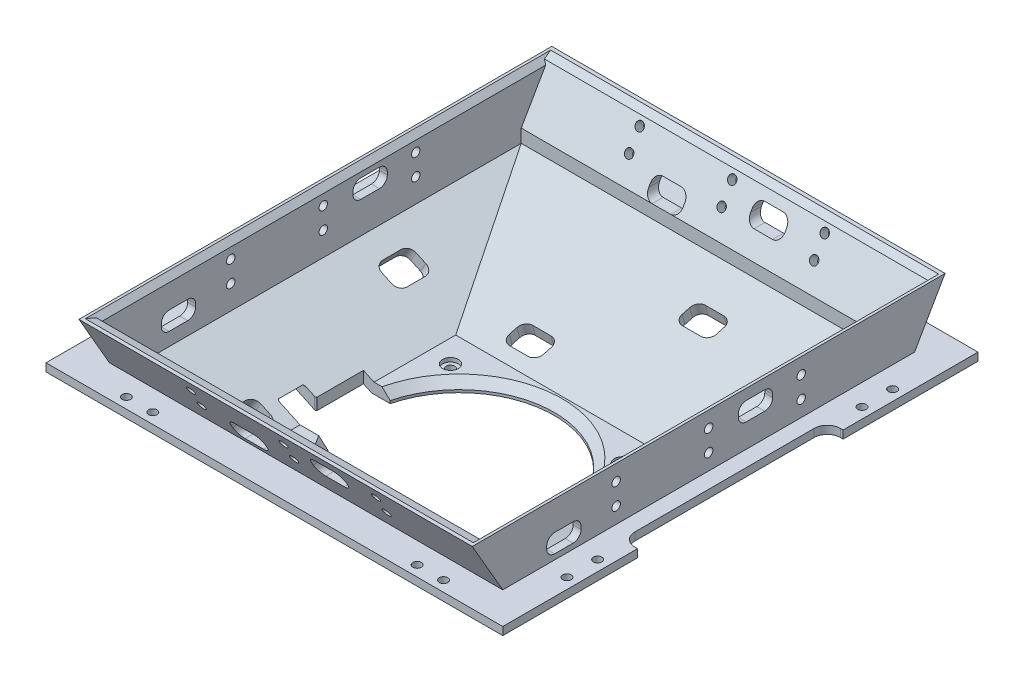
SolidWorks part; units mm, degrees
ref_plane "前视基准面" through (0, 0, 0) normal (0, 0, 1) x (1, 0, 0)
ref_plane "上视基准面" through (0, 0, 0) normal (0, 1, 0) x (1, 0, 0)
ref_plane "右视基准面" through (0, 0, 0) normal (1, 0, 0) x (0, 0, -1)
sketch "草图1" plane through (0, 0, 0) normal (0, 1, 0) x (1, 0, 0)
  line L1 (-42, -41) -> (42, -41)
  line L2 (-42, -41) -> (-42, 41)
  line L3 (-42, 41) -> (42, 41)
  line L4 (42, -41) -> (42, 41)
  line L5 (-42, -41) -> (42, 41) construction
  line L6 (-42, 41) -> (42, -41) construction
  point P0 (0, 0)
  dimension "D1" = 82
  dimension "D2" = 84
ref_plane "基准面1" through (0, 20, 0) normal (0, 1, 0) x (1, 0, 0)
sketch "草图2" plane through (0, 20, 0) normal (0, 1, 0) x (1, 0, 0)
  line L1 (-85, -55) -> (75, -55)
  line L2 (-85, -55) -> (-85, 115)
  line L3 (-85, 115) -> (75, 115)
  line L4 (75, -55) -> (75, 115)
  line L5 (-85, -55) -> (75, 115) construction
  line L6 (-85, 115) -> (75, -55) construction
  point P0 (-5, 30)
  dimension "D1" = 5
  dimension "D2" = 30
  dimension "D3" = 170
  dimension "D4" = 160
loft "放样1" add profiles "草图2", "草图1"
shell "抽壳2" thickness 10
sketch "草图3" plane through (0, 4, 0) normal (0, 1, 0) x (1, 0, 0)
  line L0 (-41.1153, 0.7758) -> (40.8825, 0.7758) construction
  line L1 (-41.1153, 40.469) -> (-41.1153, -38.9174) construction
  line L2 (40.8825, -38.9174) -> (40.8825, 40.469) construction
  circle A0 centre (-0.1164, 0.7758) radius 36
  dimension "D1" = 72
extrude "切除-拉伸1" cut sketch "草图3" against normal blind 10
sketch "草图4" plane through (0, 4, 0) normal (0, 1, 0) x (1, 0, 0)
  line L0 (-0.1164, -35.2242) -> (-0.1164, -17.9785) construction
  line L1 (0, 0) -> (-14.5879, 0) construction
  circle A0 centre (-32.6164, -30) radius 1.6
  circle A1 centre (-0.1164, 0.7758) radius 36 construction
  circle A2 centre (32.3836, -30) radius 1.6
  circle A3 centre (-32.6164, 30) radius 1.6
  circle A4 centre (32.3836, 30) radius 1.6
  dimension "D1" = 3.2
  dimension "D2" = 32.5
  dimension "D3" = 30
extrude "切除-拉伸2" cut sketch "草图4" against normal blind 10
sketch "草图5" plane through (0, 4, 0) normal (0, 1, 0) x (1, 0, 0)
  line L0 (-0.1164, 36.7758) -> (-0.1164, 21.4642) construction
  line L1 (0, 0) -> (8.9854, 0) construction
  circle A0 centre (-32.6164, 30) radius 3
  circle A1 centre (-0.1164, 0.7758) radius 36 construction
  circle A2 centre (32.3836, 30) radius 3
  circle A3 centre (-32.6164, -30) radius 3
  circle A4 centre (32.3836, -30) radius 3
  dimension "D1" = 6
extrude "切除-拉伸3" cut sketch "草图5" against normal blind 1.5
sketch "草图6" plane through (0, 20, 0) normal (0, 1, 0) x (1, 0, 0)
  line L0 (-40.1164, 0.5963) -> (-30.4123, 0.5963) construction
  line L1 (-45.1164, -18.4037) -> (-0.1164, -18.4037)
  line L2 (-45.1164, -18.4037) -> (-45.1164, 9.5963)
  line L3 (-45.1164, 9.5963) -> (-0.1164, 9.5963)
  line L4 (-0.1164, -18.4037) -> (-0.1164, 9.5963)
  dimension "D1" = 9
  dimension "D2" = 28
extrude "切除-拉伸4" cut sketch "草图6" against normal through all
sketch "草图7" plane through (0, 20, 0) normal (0, 1, 0) x (1, 0, 0)
  line L0 (-75.5153, 99.669) -> (-75.5153, -50.1174) construction
  line L1 (-75.5153, -50.1174) -> (67.2825, -50.1174) construction
  line L2 (67.2825, -50.1174) -> (67.2825, 99.669) construction
  line L3 (67.2825, 99.669) -> (-75.5153, 99.669) construction
  line L4 (-75.5153, 99.669) -> (-75.5153, -50.1174)
  line L5 (-75.5153, -50.1174) -> (67.2825, -50.1174)
  line L6 (67.2825, -50.1174) -> (67.2825, 99.669)
  line L7 (67.2825, 99.669) -> (-75.5153, 99.669)
  line L9 (-90.5153, 114.669) -> (82.2825, 114.669)
  line L10 (-90.5153, 114.669) -> (-90.5153, -65.1174)
  line L11 (-90.5153, -65.1174) -> (82.2825, -65.1174)
  line L12 (82.2825, 114.669) -> (82.2825, -65.1174)
  dimension "D1" = 15
  dimension "D2" = 15
  dimension "D3" = 15
  dimension "D4" = 15
extrude "凸台-拉伸1" add sketch "草图7" along normal blind 3
sketch "草图8" plane through (0, 23, 0) normal (0, 1, 0) x (1, 0, 0)
  line L0 (82.2825, -65.1174) -> (82.2825, 114.669) construction
  line L1 (82.2825, -14.1174) -> (76.2825, -14.1174)
  line L2 (82.2825, -14.1174) -> (82.2825, 63.669)
  line L3 (82.2825, 63.669) -> (76.2825, 63.669)
  line L4 (76.2825, -14.1174) -> (76.2825, 63.669)
  line L5 (-90.5153, -65.1174) -> (82.2825, -65.1174) construction
  line L6 (82.2825, 114.669) -> (-90.5153, 114.669) construction
  dimension "D1" = 51
  dimension "D2" = 51
  dimension "D3" = 6
extrude "切除-拉伸5" cut sketch "草图8" against normal blind 4
fillet "圆角1" radius 5 2 edges at (76.2825, 21.5, -63.669) (76.2825, 21.5, 14.1174)
sketch "草图9" plane through (0, 23, 0) normal (0, 1, 0) x (1, 0, 0)
  line L0 (-75.5153, -50.1174) -> (67.2825, -50.1174) construction
  line L1 (-75.5153, 99.669) -> (-75.5153, -50.1174) construction
  line L2 (67.2825, 99.669) -> (-75.5153, 99.669) construction
  line L3 (67.2825, -50.1174) -> (67.2825, 99.669) construction
  line L4 (-75.5153, -50.1174) -> (67.2825, -50.1174)
  line L5 (-75.5153, 99.669) -> (-75.5153, -50.1174)
  line L6 (67.2825, 99.669) -> (-75.5153, 99.669)
  line L7 (67.2825, -50.1174) -> (67.2825, 99.669)
  line L16 (70.2825, 102.669) -> (-78.5153, 102.669)
  line L17 (-78.5153, 102.669) -> (-78.5153, -53.1174)
  line L18 (-78.5153, -53.1174) -> (70.2825, -53.1174)
  line L19 (70.2825, -53.1174) -> (70.2825, 102.669)
  dimension "D1" = 3
extrude "凸台-拉伸2" add sketch "草图9" along normal blind 20
sketch "草图10" plane through (70.2825, 0, 0) normal (1, 0, 0) x (0, 0, -1)
  line L0 (102.669, 43) -> (114.216, 43)
  line L1 (114.216, 43) -> (102.669, 23)
  line L2 (63.669, 23) -> (114.669, 23) construction
  line L3 (102.669, 43) -> (102.669, 23) construction
  line L4 (102.669, 23) -> (102.669, 43)
  line L5 (24.7758, 43) -> (24.7758, 27.2549) construction
  line L6 (-53.1174, 43) -> (102.669, 43) construction
  line L7 (-53.1174, 23) -> (-53.1174, 43)
  line L8 (-64.6644, 43) -> (-53.1174, 23)
  line L9 (-53.1174, 43) -> (-64.6644, 43)
  dimension "D1" = 60
extrude "凸台-拉伸3" add sketch "草图10" against normal up to surface (148.7978 mm away)
chamfer "倒角1" distance 18 angle 30 1 edges at (-4.1164, 43, 50.1174)
chamfer "倒角2" distance 18 angle 30 1 edges at (-4.1164, 43, -99.669)
sketch "草图11" plane through (70.2825, 0, 0) normal (1, 0, 0) x (0, 0, -1)
  line L0 (-61.2003, 37) -> (104.4055, 37) construction
  line L1 (-64.6644, 43) -> (-53.1174, 23) construction
  line L2 (-64.6644, 43) -> (114.216, 43) construction
  line L3 (24.7758, 43) -> (24.7758, 24.953) construction
  circle A0 centre (24.7758, 37) radius 1.6
  circle A1 centre (-10.2242, 37) radius 1.6
  circle A2 centre (59.7758, 37) radius 1.6
  circle A3 centre (59.7758, 29) radius 1.6
  circle A4 centre (24.7758, 29) radius 1.6
  circle A5 centre (-10.2242, 29) radius 1.6
  dimension "D2" = 3.2
  dimension "D3" = 3.2
  dimension "D4" = 35
  dimension "D1" = 6
  dimension "D5" = 2
extrude "切除-拉伸6" cut sketch "草图11" against normal through all
sketch "草图12" plane through (0, -38.707, -67.0424) normal (0, -0.5, -0.866) x (-1, 0, 0)
  line L0 (-70.2825, 88.3471) -> (78.5153, 88.3471) construction
  line L1 (-70.2825, 71.2531) -> (-70.2825, 94.3471) construction
  line L2 (78.5153, 94.3471) -> (78.5153, 71.2531) construction
  line L3 (78.5153, 94.3471) -> (-70.2825, 94.3471) construction
  line L4 (4.1164, 94.3471) -> (4.1164, 80.1243) construction
  circle A0 centre (-30.8836, 88.3471) radius 1.6
  circle A1 centre (4.1164, 88.3471) radius 1.6
  circle A2 centre (39.1164, 88.3471) radius 1.6
  circle A3 centre (-30.8836, 80.3471) radius 1.6
  circle A4 centre (4.1164, 80.3471) radius 1.6
  circle A5 centre (39.1164, 80.3471) radius 1.6
  dimension "D2" = 3.2
  dimension "D3" = 3.2
  dimension "D4" = 35
  dimension "D5" = 2
  dimension "D1" = 6
extrude "切除-拉伸7" cut sketch "草图12" against normal blind 20
sketch "草图14" plane through (0, -17.2505, 29.8787) normal (0, -0.5, 0.866) x (1, 0, 0)
  line L0 (-78.5153, 63.5713) -> (70.2825, 63.5713) construction
  line L1 (-78.5153, 46.4773) -> (-78.5153, 69.5713) construction
  line L2 (70.2825, 69.5713) -> (70.2825, 46.4773) construction
  line L3 (-78.5153, 69.5713) -> (70.2825, 69.5713) construction
  line L4 (-4.1164, 69.5713) -> (-4.1164, 53.0035) construction
  circle A0 centre (-39.1164, 63.5713) radius 1.6
  circle A1 centre (-4.1164, 63.5713) radius 1.6
  circle A2 centre (30.8836, 63.5713) radius 1.6
  circle A3 centre (-39.1164, 55.5713) radius 1.6
  circle A4 centre (-4.1164, 55.5713) radius 1.6
  circle A5 centre (30.8836, 55.5713) radius 1.6
  dimension "D2" = 3.2
  dimension "D3" = 3.2
  dimension "D4" = 35
  dimension "D1" = 6
  dimension "D5" = 2
extrude "切除-拉伸8" cut sketch "草图14" against normal blind 20
sketch "草图15" plane through (0, 23, 0) normal (0, 1, 0) x (1, 0, 0)
  line L0 (78.2825, 105.4033) -> (78.2825, -48.1364) construction
  line L1 (76.2825, 24.7758) -> (60.6397, 24.7758) construction
  line L2 (76.2825, 58.669) -> (76.2825, -9.1174) construction
  line L3 (-86.5153, 114.669) -> (-86.5153, -65.1174) construction
  line L4 (82.2825, 114.669) -> (-90.5153, 114.669) construction
  line L5 (-90.5153, -65.1174) -> (82.2825, -65.1174) construction
  line L6 (-78.5153, 102.669) -> (-78.5153, -53.1174) construction
  line L7 (70.2825, -53.1174) -> (70.2825, 102.669) construction
  line L8 (82.2825, 110.669) -> (-90.5153, 110.669) construction
  line L9 (82.2825, 63.669) -> (82.2825, 114.669) construction
  line L10 (-90.5153, 114.669) -> (-90.5153, -65.1174) construction
  line L11 (-4.1164, 114.669) -> (-4.1164, 80.3757) construction
  line L12 (70.2825, 102.669) -> (-78.5153, 102.669) construction
  line L13 (82.2825, -61.1174) -> (-90.5153, -61.1174) construction
  line L14 (82.2825, -65.1174) -> (82.2825, -14.1174) construction
  line L15 (-78.5153, -53.1174) -> (70.2825, -53.1174) construction
  circle A0 centre (78.2825, -25.2242) radius 1.6
  circle A1 centre (78.2825, -36.8242) radius 1.6
  circle A2 centre (78.2825, 74.7758) radius 1.6
  circle A3 centre (78.2825, 86.3758) radius 1.6
  circle A4 centre (-86.5153, -25.2242) radius 1.6
  circle A5 centre (-86.5153, -35.2242) radius 1.6
  circle A6 centre (-86.5153, 84.7758) radius 1.6
  circle A7 centre (-86.5153, 74.7758) radius 1.6
  circle A8 centre (-64.1164, 110.669) radius 1.6
  circle A9 centre (-54.1164, 110.669) radius 1.6
  circle A10 centre (55.8836, 110.669) radius 1.6
  circle A11 centre (45.8836, 110.669) radius 1.6
  circle A12 centre (55.8836, -61.1174) radius 1.6
  circle A13 centre (45.8836, -61.1174) radius 1.6
  circle A14 centre (-64.1164, -61.1174) radius 1.6
  circle A15 centre (-54.1164, -61.1174) radius 1.6
  dimension "D1" = 3.2
  dimension "D2" = 50
  dimension "D3" = 3.2
  dimension "D4" = 10
  dimension "D6" = 3.2
  dimension "D7" = 3.2
  dimension "D8" = 10
  dimension "D9" = 50
  dimension "D12" = 3.2
  dimension "D13" = 3.2
  dimension "D14" = 10
  dimension "D15" = 50
  dimension "D17" = 3.2
  dimension "D18" = 3.2
  dimension "D19" = 10
  dimension "D20" = 50
  dimension "D5" = 8
  dimension "D10" = 8
  dimension "D11" = 8
  dimension "D16" = 8
extrude "切除-拉伸9" cut sketch "草图15" against normal blind 20
chamfer "倒角3" distance 3 angle 45 1 edges at (35.4399, 4, -6.4105)
chamfer "倒角4" distance 2 angle 45 2 edges at (67.2825, 43, -24.7758) (-75.5153, 43, -24.7758)
chamfer "倒角5" distance 1 angle 45 2 edges at (-4.1164, 43, 60.5097) (-4.1164, 43, -110.0613)
sketch "草图16" plane through (0, 0, 0) normal (0, 0, 1) x (1, 0, 0)
  line L0 (0, 0) -> (0, 54.2977) construction
  line L1 (-42, 0) -> (42, 0) construction
  line L2 (-22.5, 35.4499) -> (-22.5, -4.4976) construction
  line L3 (-29, 11) -> (-16, 11) construction
  line L4 (-29, 11) -> (-29, 4) construction
  line L5 (-29, 4) -> (-16, 4) construction
  line L6 (-16, 11) -> (-16, 4) construction
  line L7 (12, 47.4433) -> (12, 9.3355) construction
  line L9 (5.5, 39) -> (18.5, 39)
  line L10 (5.5, 39) -> (5.5, 32)
  line L11 (-29, 32) -> (-16, 32)
  line L12 (-29, 32) -> (-29, 25)
  line L13 (-29, 25) -> (-16, 25)
  line L14 (-16, 32) -> (-16, 25)
  line L15 (5.5, 32) -> (18.5, 32)
  line L16 (18.5, 39) -> (18.5, 32)
  line L17 (5.5, 18) -> (18.5, 18) construction
  line L18 (5.5, 18) -> (5.5, 11) construction
  line L19 (5.5, 11) -> (18.5, 11) construction
  line L20 (18.5, 18) -> (18.5, 11) construction
  dimension "D1" = 7
  dimension "D2" = 13
  dimension "D3" = 22.5
  dimension "D4" = 12
  dimension "D5" = 11
  dimension "D6" = 4
  dimension "D7" = 14
  dimension "D8" = 14
extrude "切除-拉伸10" cut sketch "草图16" against normal through all and the other way through all
sketch "草图17" plane through (0, 0, 0) normal (1, 0, 0) x (0, 0, -1)
  line L0 (0, 0) -> (0, 7) construction
  line L1 (-30, 51.8947) -> (-30, 1.2694) construction
  line L2 (42.5, 59.7632) -> (42.5, -1.8692) construction
  line L3 (-41, 0) -> (41, 0) construction
  line L4 (-36.5, 25) -> (-23.5, 25)
  line L5 (-36.5, 25) -> (-36.5, 32)
  line L6 (-36.5, 32) -> (-23.5, 32)
  line L7 (-23.5, 25) -> (-23.5, 32)
  line L8 (-36.5, 25) -> (-23.5, 32) construction
  line L9 (-36.5, 32) -> (-23.5, 25) construction
  line L10 (-36.5, 4) -> (-23.5, 4) construction
  line L11 (-36.5, 4) -> (-36.5, 11) construction
  line L12 (-36.5, 11) -> (-23.5, 11) construction
  line L13 (-23.5, 4) -> (-23.5, 11) construction
  line L14 (-36.5, 4) -> (-23.5, 11) construction
  line L15 (-36.5, 11) -> (-23.5, 4) construction
  line L16 (36, 32) -> (49, 32)
  line L17 (36, 32) -> (36, 39)
  line L18 (36, 39) -> (49, 39)
  line L19 (49, 32) -> (49, 39)
  line L20 (36, 32) -> (49, 39) construction
  line L21 (36, 39) -> (49, 32) construction
  line L22 (36, 11) -> (49, 11) construction
  line L23 (36, 11) -> (36, 18) construction
  line L24 (36, 18) -> (49, 18) construction
  line L25 (49, 11) -> (49, 18) construction
  line L26 (36, 11) -> (49, 18) construction
  line L27 (36, 18) -> (49, 11) construction
  point P2 (42.5, 14.5)
  point P7 (-30, 28.5)
  point P13 (-30, 7.5)
  point P18 (42.5, 35.5)
  point P29 (47.3153, -1.8692)
  dimension "D1" = 7
  dimension "D2" = 13
  dimension "D3" = 4
  dimension "D4" = 14
  dimension "D5" = 11
  dimension "D6" = 14
  dimension "D7" = 42.5
  dimension "D8" = 30
extrude "切除-拉伸11" cut sketch "草图17" against normal through all both and the other way through all
sketch "草图18" plane through (11.2827, -18.6165, 0) normal (0.5183, -0.8552, 0) x (0.8552, 0.5183, 0)
  line L0 (80.3192, -36) -> (48.1091, -36) construction
  line L1 (80.3192, -49) -> (45.536, -49) construction
  line L2 (76.6911, 23.5) -> (49.6106, 23.5) construction
  line L3 (76.6911, 36.5) -> (37.6476, 36.5) construction
  line L4 (35.9183, 41) -> (35.9183, -41) construction
  line L5 (40.9183, 36.5) -> (50.9183, 36.5)
  line L6 (40.9183, 36.5) -> (40.9183, 23.5)
  line L7 (40.9183, 23.5) -> (50.9183, 23.5)
  line L8 (50.9183, 36.5) -> (50.9183, 23.5)
  line L10 (55.9183, -36) -> (65.9183, -36)
  line L11 (55.9183, -36) -> (55.9183, -49)
  line L12 (55.9183, -49) -> (65.9183, -49)
  line L13 (65.9183, -36) -> (65.9183, -49)
  point P22 (0, 0)
  dimension "D1" = 5
  dimension "D2" = 10
  dimension "D3" = 20
  dimension "D4" = 10
extrude "切除-拉伸12" cut sketch "草图18" against normal through all both and the other way through all
sketch "草图20" plane through (0, -19.2617, 27.5168) normal (0, -0.5735, 0.8192) x (1, 0, 0)
  line L0 (18.5, 67.7083) -> (18.5, 23.512) construction
  line L1 (-42, 23.512) -> (42, 23.512) construction
  line L2 (5.5, 67.7083) -> (5.5, 23.512) construction
  line L3 (-16, 59.656) -> (-16, 23.512) construction
  line L4 (-29, 59.656) -> (-29, 23.512) construction
  line L6 (-29, 35.512) -> (-16, 35.512)
  line L7 (-29, 35.512) -> (-29, 27.512)
  line L8 (-29, 27.512) -> (-16, 27.512)
  line L9 (-16, 35.512) -> (-16, 27.512)
  line L10 (5.5, 44.512) -> (18.5, 44.512)
  line L11 (5.5, 44.512) -> (5.5, 36.512)
  line L12 (5.5, 36.512) -> (18.5, 36.512)
  line L13 (18.5, 44.512) -> (18.5, 36.512)
  dimension "D1" = 8
  dimension "D2" = 4
  dimension "D3" = 13
extrude "切除-拉伸14" cut sketch "草图20" against normal through all both and the other way through all
sketch "草图21" plane through (0, -10.3268, -2.791) normal (0, -0.9654, -0.2609) x (1, 0, 0)
  line L0 (18.5, -118.206) -> (18.5, -40.1109) construction
  line L1 (40.8825, -40.1109) -> (-41.1153, -40.1109) construction
  line L2 (5.5, -118.206) -> (5.5, -39.5799) construction
  line L3 (42, -39.5799) -> (-42, -39.5799) construction
  line L4 (-16, -112.4781) -> (-16, -39.5799) construction
  line L5 (-29, -112.4781) -> (-29, -39.5799) construction
  line L7 (-29, -45.5799) -> (-16, -45.5799)
  line L8 (-29, -45.5799) -> (-29, -54.5799)
  line L9 (-29, -54.5799) -> (-16, -54.5799)
  line L10 (-16, -45.5799) -> (-16, -54.5799)
  line L11 (5.5, -77.5799) -> (18.5, -77.5799)
  line L12 (5.5, -77.5799) -> (5.5, -86.5799)
  line L13 (5.5, -86.5799) -> (18.5, -86.5799)
  line L14 (18.5, -77.5799) -> (18.5, -86.5799)
  dimension "D1" = 9
  dimension "D2" = 9
  dimension "D3" = 6
  dimension "D4" = 38
extrude "切除-拉伸15" cut sketch "草图21" against normal up to next
fillet "圆角2" radius 3 8 edges at (18.5, 32, -105.7878) (18.5, 39, -109.8292) (5.5, 39, -109.8292) (5.5, 32, -105.7878) (-29, 25, -101.7463) (-29, 32, -105.7878) (-16, 32, -105.7878) (-16, 25, -101.7463)
fillet "圆角3" radius 3 8 edges at (-16, 25, 52.1947) (-16, 32, 56.2362) (-29, 32, 56.2362) (-29, 25, 52.1947) (5.5, 32, 56.2362) (5.5, 39, 60.2776) (18.5, 39, 60.2776) (18.5, 32, 56.2362)
fillet "圆角4" radius 3 16 edges at (-77.0153, 32, 36.5) (-77.0153, 32, 23.5) (-77.0153, 25, 23.5) (-77.0153, 25, 36.5) (-77.0153, 32, -36) (-77.0153, 39, -36) (-77.0153, 39, -49) (-77.0153, 32, -49) (68.7825, 32, -49) (68.7825, 39, -49) (68.7825, 39, -36) (68.7825, 32, -36) (68.7825, 25, 23.5) (68.7825, 32, 23.5) (68.7825, 32, 36.5) (68.7825, 25, 36.5)
fillet "圆角5" radius 3 16 edges at (5.5, 18.3508, 51.4042) (18.5, 18.3508, 51.4042) (18.5, 11.7969, 46.8165) (5.5, 11.7969, 46.8165) (-16, 4.4239, 41.6554) (-16, 10.9777, 46.2431) (-29, 10.9777, 46.2431) (-29, 4.4239, 41.6554) (18.5, 11.8453, -77.162) (18.5, 14.1935, -85.8503) (5.5, 14.1935, -85.8503) (5.5, 11.8453, -77.162) (-16, 3.4962, -46.2704) (-16, 5.8444, -54.9586) (-29, 5.8444, -54.9586) (-29, 3.4962, -46.2704)
sketch "草图24" plane through (0, 0, 0) normal (1, 0, 0) x (0, 0, -1)
  line L1 (-18.4037, 0) -> (-8.4037, 0)
  line L2 (-18.4037, 0) -> (-18.4037, 8)
  line L3 (-18.4037, 8) -> (-8.4037, 8)
  line L4 (-8.4037, 0) -> (-8.4037, 8)
  dimension "D1" = 8
  dimension "D2" = 10
extrude "切除-拉伸17" cut sketch "草图24" against normal through all
fillet "圆角6" radius 0.5 3 edges at (-54.4576, 8, 18.4037) (-54.4576, 8, 8.4037) (-45.1164, 3.6552, 8.4037)
fillet "圆角7" radius 3 8 edges at (58.0674, 12.0764, -36) (58.0674, 12.0764, -49) (66.6193, 17.2594, -49) (66.6193, 17.2594, -36) (53.7914, 9.4849, 23.5) (53.7914, 9.4849, 36.5) (45.2394, 4.3019, 36.5) (45.2394, 4.3019, 23.5)
mirror "镜向1" about plane through (0, 0, 0) normal (1, 0, 0) of "圆角7", "切除-拉伸12"
